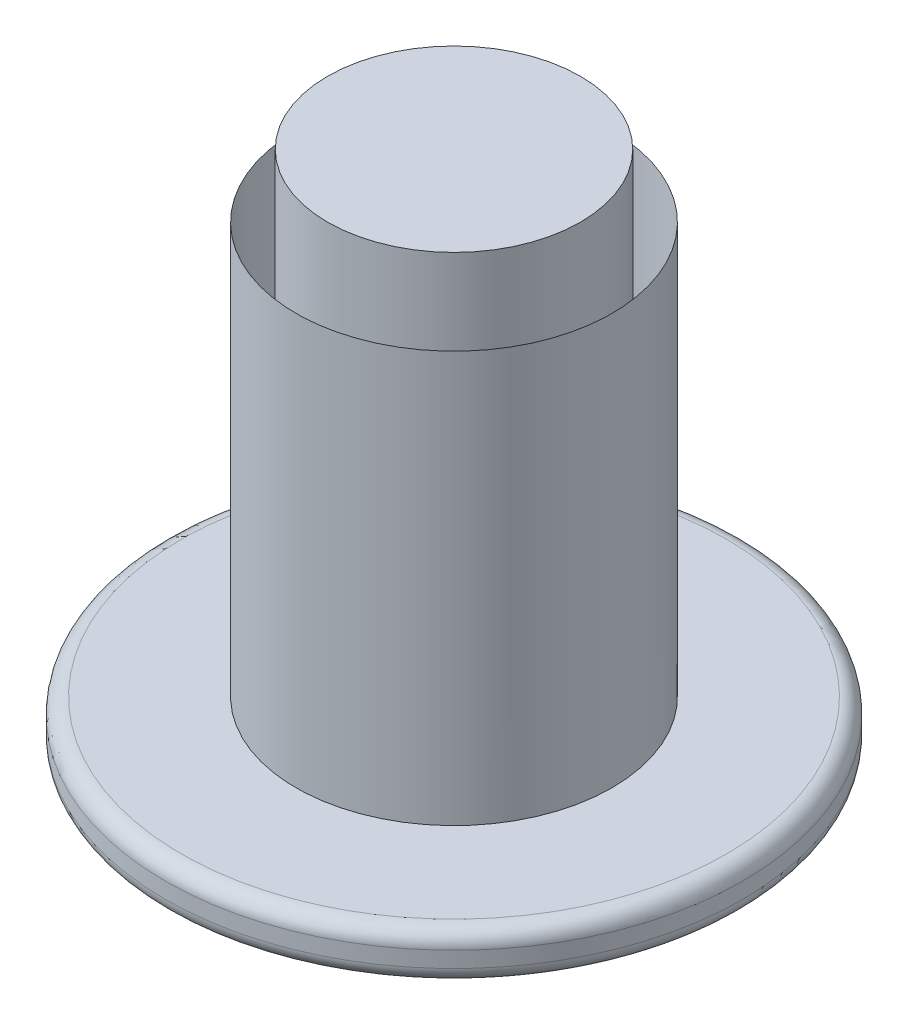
SolidWorks part; units mm, degrees
ref_plane "X_Y" through (0, 0, 0) normal (0, 0, 1) x (1, 0, 0)
ref_plane "Z_X" through (0, 0, 0) normal (0, 1, 0) x (1, 0, 0)
ref_plane "Y_Z" through (0, 0, 0) normal (1, 0, 0) x (0, 0, -1)
sketch "Sketch1" plane through (0, 0, 0) normal (0, 0, 1) x (1, 0, 0)
  line L0 (0, 0) -> (1.825, 0)
  line L1 (1.825, 0) -> (1.825, 0.3)
  line L2 (1.825, 0.3) -> (0.8, 0.3)
  line L3 (0.8, 0.3) -> (0.8, 3.3)
  line L4 (0.8, 3.3) -> (0, 3.3)
  line L5 (0, 3.3) -> (0, 0)
  dimension "D1" = 0.3
  dimension "D2" = 3.65
  dimension "D3" = 3
  dimension "D4" = 1.6
revolve "Revolve1" add sketch "Sketch1" angle 360 about L5
sketch "Sketch2" plane through (0, 0.3, 0) normal (0, 1, 0) x (1, 0, 0)
  circle A0 centre (0, 0) radius 1
  dimension "D1" = 2
surface "Surface-Extrude1" sketch "Sketch2" parameters "D1"=0.4
fillet "Fillet1" radius 0.1 2 edges at (0, 0.3, 1.825) (0, 0, 1.825)
